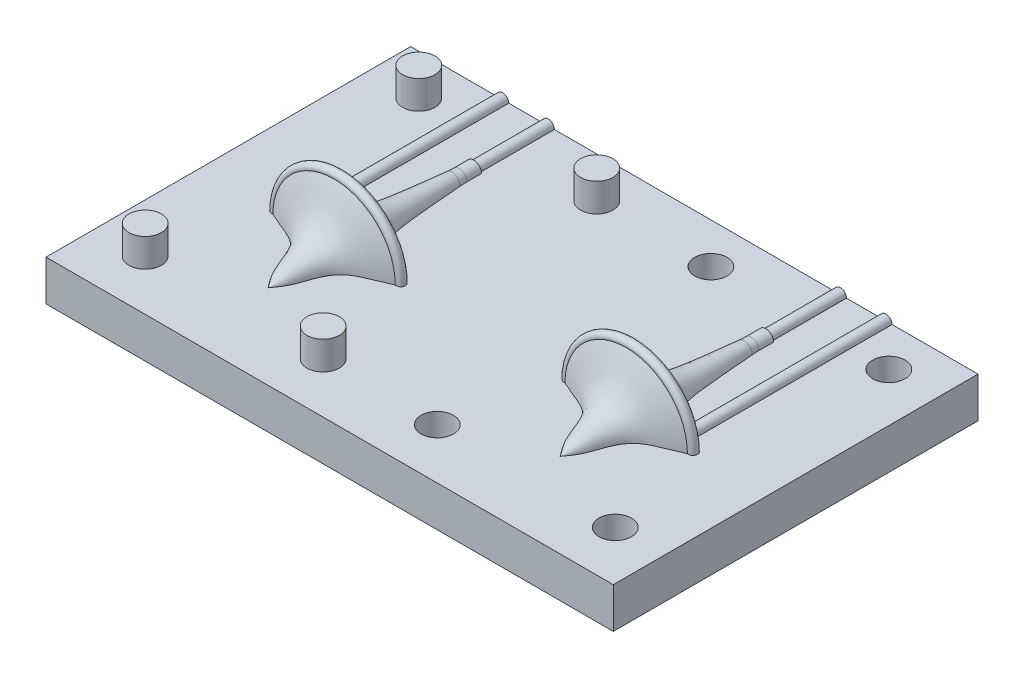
SolidWorks part; units mm, degrees
ref_plane "Front Plane" through (0, 0, 0) normal (0, 0, 1) x (1, 0, 0)
ref_plane "Top Plane" through (0, 0, 0) normal (0, 1, 0) x (1, 0, 0)
ref_plane "Right Plane" through (0, 0, 0) normal (1, 0, 0) x (0, 0, -1)
sketch "Sketch1" plane through (0, 0, 0) normal (0, 1, 0) x (1, 0, 0)
  line L0 (-84.5109, 45.2978) -> (-84.5109, -44.7022) construction
  line L1 (-84.5109, -44.7022) -> (55.4891, -44.7022) construction
  line L2 (55.4891, -44.7022) -> (55.4891, 45.2978) construction
  line L3 (55.4891, 45.2978) -> (-84.5109, 45.2978) construction
  line L4 (-48.4251, 20.4965) -> (-46.412, -2.4028) construction
  line L5 (-46.412, -2.4028) -> (-47.3246, -2.4577) construction
  line L6 (-47.3246, -2.4577) -> (-35.2983, -6.4583) construction
  line L7 (-28.8221, -7.5128) -> (-28.8221, -34.2879) construction
  line L13 (-50.4094, -33.8488) -> (-50.4094, 37.1144) construction
  line L18 (-35.2983, -6.4583) -> (-35.2983, -25.2008) construction
  line L19 (-48.5019, 22.2479) -> (-48.5019, 25.8649)
  line L20 (-50.4094, 25.8649) -> (-50.4094, 16.898)
  line L21 (-50.4094, 16.898) -> (-50.4094, -24.8935)
  line L22 (-48.5019, 25.8649) -> (-50.4094, 25.8649)
  line L23 (-50.4094, -24.8935) -> (-50.4094, 24.7807) construction
  line L27 (-35.2983, -8.6133) -> (-43.9657, -12.7178) construction
  line L28 (-43.9657, -12.7178) -> (-45.5987, -10.6164) construction
  line L29 (-45.5987, -10.6164) -> (-47.7764, -20.0888) construction
  line L30 (-47.7764, -20.0888) -> (-46.7019, -20.0178) construction
  line L31 (-46.7019, -20.0178) -> (-50.4094, -24.8935) construction
  arc A0 (-48.4251, 20.4965) -> (-48.5019, 22.2479) centre (-28.5019, 22.2479) cw
  arc A1 (-35.2983, -6.4583) -> (-35.2983, -8.6133) centre (-35.0157, -7.5358) cw
  spline_without_curve S2
  spline_without_curve S3
  point P2 (-48.5019, 20.4965)
  dimension "D3" = 20
  dimension "D1" = 90
  dimension "D2" = 140
revolve "Revolve1" add sketch "Sketch1" angle 180 about L13
sketch "Sketch3" plane through (0, 0, 0) normal (0, 1, 0) x (1, 0, 0)
  line L0 (-95.1229, 25.8649) -> (0, 25.8649) construction
  line L2 (-66.9171, 25.8649) -> (-66.9171, -42.971) construction
  line L3 (-66.9171, -24.8935) -> (-8.7726, -24.8935) construction
  line L4 (-33.9017, 25.8649) -> (-33.9017, -24.8935) construction
  line L5 (-93.6538, 66.9704) -> (11.3014, -94.3896) construction
  line L6 (-105.7035, -84.5245) -> (-4.1164, 71.6575) construction
  line L7 (-48.5019, 25.8649) -> (-52.3169, 25.8649) construction
  circle A2 centre (-72.3696, 34.2477) radius 4
  circle A3 centre (-28.4493, 34.2477) radius 4
  circle A4 centre (-72.3696, -33.2762) radius 4
  circle A5 centre (-28.4493, -33.2762) radius 4
  arc A6 (-35.2983, -8.6133) -> (-35.2983, -6.4583) centre (-35.0157, -7.5358) ccw construction
  arc A7 (-65.5206, -6.4583) -> (-65.5206, -8.6133) centre (-65.8032, -7.5358) ccw construction
  dimension "D1" = 8
  dimension "D2" = 8
  dimension "D3" = 8
  dimension "D4" = 8
  dimension "D5" = 10
  dimension "D6" = 10
  dimension "D7" = 10
  dimension "D8" = 10
extrude "Boss-Extrude1" add sketch "Sketch3" along normal blind 7 separate body
sketch "Sketch4" plane through (0, 0, 0) normal (0, 1, 0) x (1, 0, 0)
  line L0 (-14.3696, -45.7523) -> (-14.3696, 44.2477) construction
  line L1 (-84.3696, 44.2477) -> (55.6304, 44.2477)
  line L2 (-84.3696, 44.2477) -> (-84.3696, -45.7523)
  line L3 (-84.3696, -45.7523) -> (55.6304, -45.7523)
  line L4 (55.6304, 44.2477) -> (55.6304, -45.7523)
  circle A0 centre (-72.3696, 34.2477) radius 4 construction
  dimension "D3" = 12
  dimension "D4" = 10
  dimension "D1" = 140
  dimension "D2" = 90
extrude "Boss-Extrude2" add sketch "Sketch4" against normal blind 10
ref_plane "Plane1" through (-14.3696, 0, 0) normal (1, 0, 0) x (0, 0, -1)
mirror "Mirror3" about plane through (-14.3696, 0, 0) normal (1, 0, 0) of "Revolve1"
sketch "Sketch7" plane through (0, 0, 0) normal (0, 1, 0) x (1, 0, 0)
  line L0 (-14.3696, 44.2477) -> (-14.3696, -45.7523) construction
  line L1 (55.6304, 44.2477) -> (-84.3696, 44.2477) construction
  line L2 (-84.3696, -45.7523) -> (55.6304, -45.7523) construction
  circle A0 centre (-72.3696, -33.2762) radius 4 construction
  circle A1 centre (-28.4493, -33.2762) radius 4 construction
  circle A2 centre (-28.4493, 34.2477) radius 4 construction
  circle A3 centre (-72.3696, 34.2477) radius 4 construction
  circle A4 centre (-72.3696, -33.2762) radius 4 construction
  circle A5 centre (-28.4493, -33.2762) radius 4 construction
  circle A6 centre (-28.4493, 34.2477) radius 4 construction
  circle A7 centre (-72.3696, 34.2477) radius 4 construction
  circle A8 centre (43.6304, 34.2477) radius 4
  circle A9 centre (-0.2899, 34.2477) radius 4
  circle A10 centre (-0.2899, -33.2762) radius 4
  circle A11 centre (43.6304, -33.2762) radius 4
extrude "Cut-Extrude1" cut sketch "Sketch7" against normal blind 7
sketch "Sketch9" plane through (0, 0, 0) normal (0, 1, 0) x (1, 0, 0)
  line L0 (21.6703, 25.8649) -> (23.1703, 25.8649)
  line L1 (21.6703, 25.8649) -> (21.6703, 44.2477)
  line L2 (23.1703, 25.8649) -> (23.1703, 44.2477)
  line L3 (21.6703, 44.2477) -> (23.1703, 44.2477)
  line L4 (23.5778, 25.8649) -> (19.7628, 25.8649) construction
  line L5 (23.5778, 25.8649) -> (19.7628, 25.8649) construction
  line L6 (55.6304, 44.2477) -> (-84.3696, 44.2477) construction
  dimension "D1" = 1.5
revolve "Revolve2" add sketch "Sketch9" angle 180 about L1
mirror "Mirror4" about plane through (-14.3696, 0, 0) normal (1, 0, 0) of "Revolve2"
sketch "Sketch10" plane through (0, 0, 0) normal (0, 1, 0) x (1, 0, 0)
  line L0 (-63.1655, -5.662) -> (-61.6655, -5.662)
  line L1 (-63.1655, -5.662) -> (-63.1655, 44.2477)
  line L2 (-61.6655, -5.662) -> (-61.6655, 44.2477)
  line L3 (-63.1655, 44.2477) -> (-61.6655, 44.2477)
  line L4 (-51.9094, 44.2477) -> (-84.3696, 44.2477) construction
  spline S0 degree 3 poles (-65.5206, -6.4583) (-53.4942, -2.4577) (-54.4068, -2.4028) (-52.3937, 20.4965) knots 0 0 0 0 1 1 1 1 construction
  dimension "D1" = 1.5
revolve "Revolve3" add sketch "Sketch10" angle 180 about L2
mirror "Mirror5" about plane through (-14.3696, 0, 0) normal (1, 0, 0) of "Revolve3"
equation "\"Radius\"= 1.5mm"
